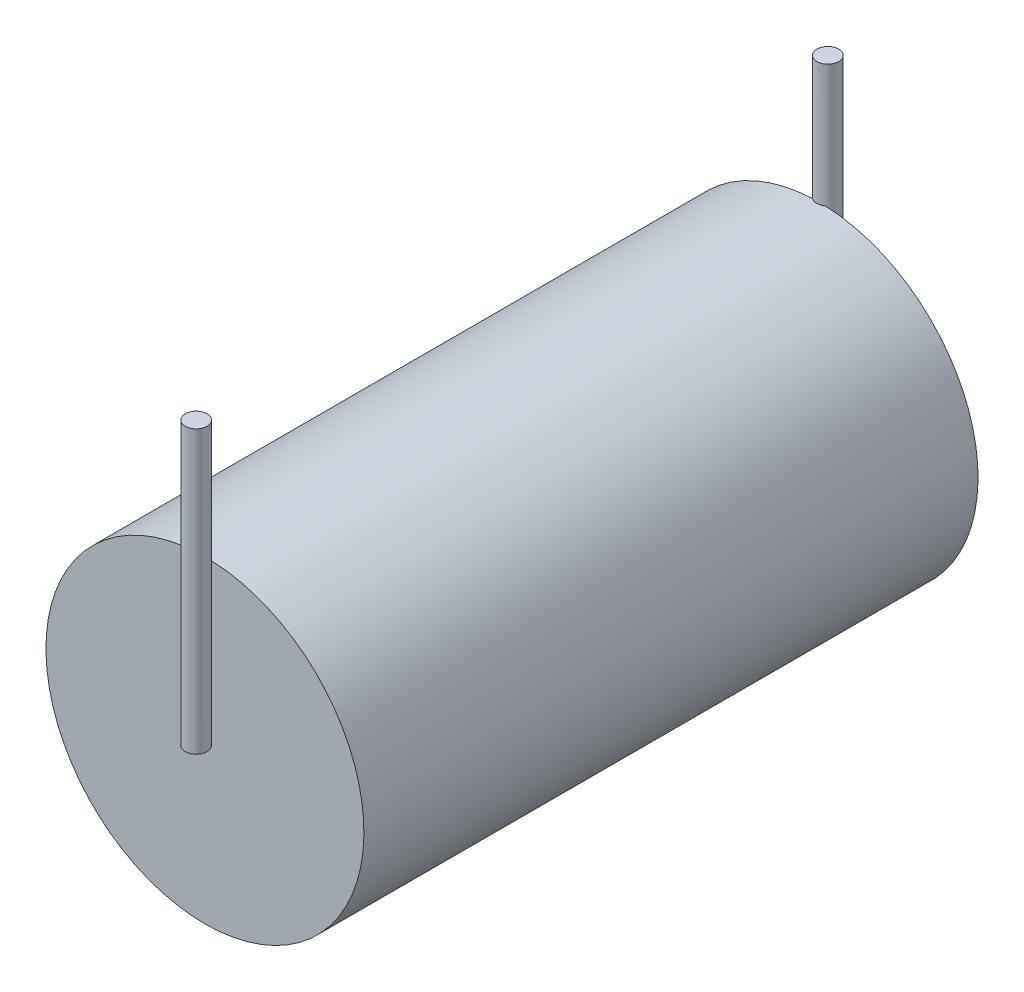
SolidWorks part; units mm, degrees
ref_plane "Front Plane" through (0, 0, 0) normal (0, 0, 1) x (1, 0, 0)
ref_plane "Top Plane" through (0, 0, 0) normal (0, 1, 0) x (1, 0, 0)
ref_plane "Right Plane" through (0, 0, 0) normal (1, 0, 0) x (0, 0, -1)
sketch "Sketch1" plane through (0, 0, 0) normal (0, 0, 1) x (1, 0, 0)
  circle A0 centre (0, 0) radius 5.7531
  dimension "D1" = 11.5062
extrude "Extrude1" add sketch "Sketch1" along normal blind 22.225
sketch "Sketch2" plane through (0, 0, 0) normal (0, 1, 0) x (1, 0, 0)
  line L0 (0, 1.2347) -> (0, -23.1753) construction
  line L1 (-5.7531, -11.1125) -> (5.7531, -11.1125) construction
  line L2 (-5.7531, 0) -> (-5.7531, -22.225) construction
  line L3 (5.7531, -22.225) -> (5.7531, 0) construction
  circle A0 centre (0, 0.3175) radius 0.3937
  circle A1 centre (0, -22.5425) radius 0.3937
  dimension "D1" = 0.7874
  dimension "D2" = 22.86
extrude "Extrude2" add sketch "Sketch2" along normal blind 10.1981
sketch "Sketch3" plane through (0, 10.1981, 0) normal (0, 1, 0) x (-1, 0, 0)
  point P0 (0, -0.3175)
  point P1 (0, 22.5425)
  point P3 (-3.1522, 26.4325)
